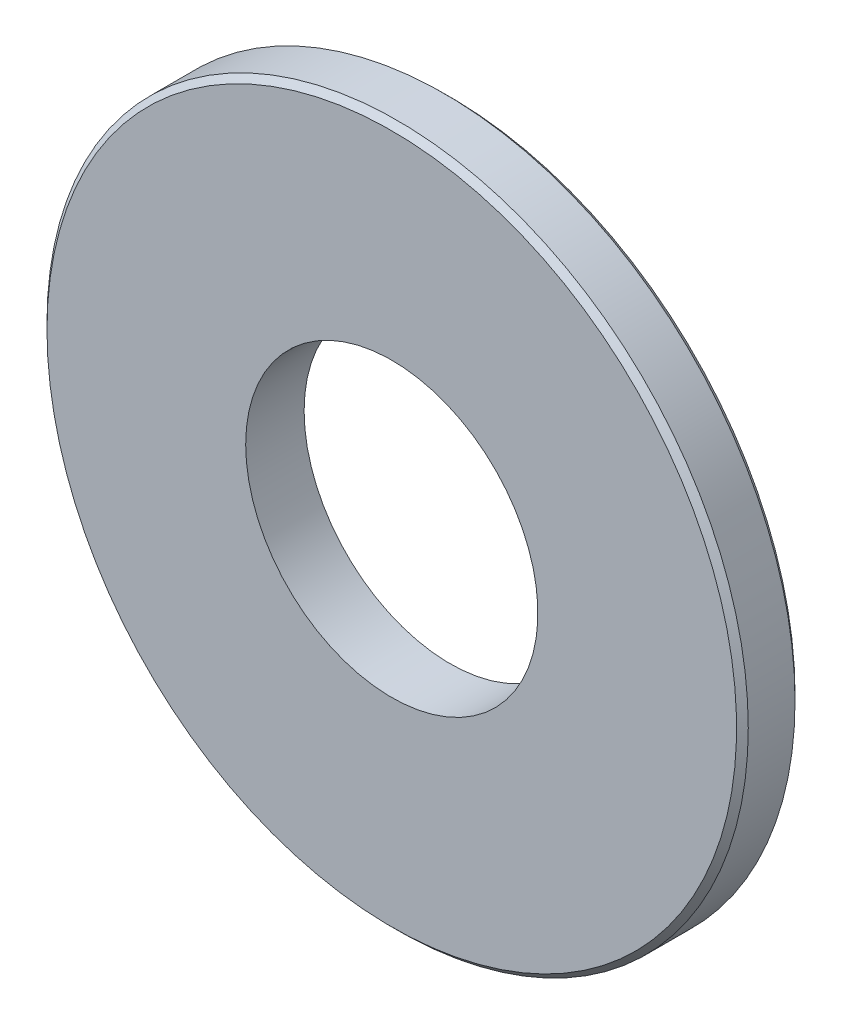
SolidWorks part; units mm, degrees
ref_plane "Plane1" through (0, 0, 0) normal (0, 0, 1) x (1, 0, 0)
ref_plane "Plane2" through (0, 0, 0) normal (0, 1, 0) x (1, 0, 0)
ref_plane "Plane3" through (0, 0, 0) normal (1, 0, 0) x (0, 0, -1)
sketch "Esquisse1" plane through (0, 0, 0) normal (0, 0, 1) x (1, 0, 0)
  circle A0 centre (0, 0) radius 6
  circle A1 centre (0, 0) radius 2.5
  dimension "D1" = 12
  dimension "D2" = 5
extrude "Base-Extrusion" add sketch "Esquisse1" along normal blind 1
chamfer "Chanfrein1" distance 0.1 angle 45
